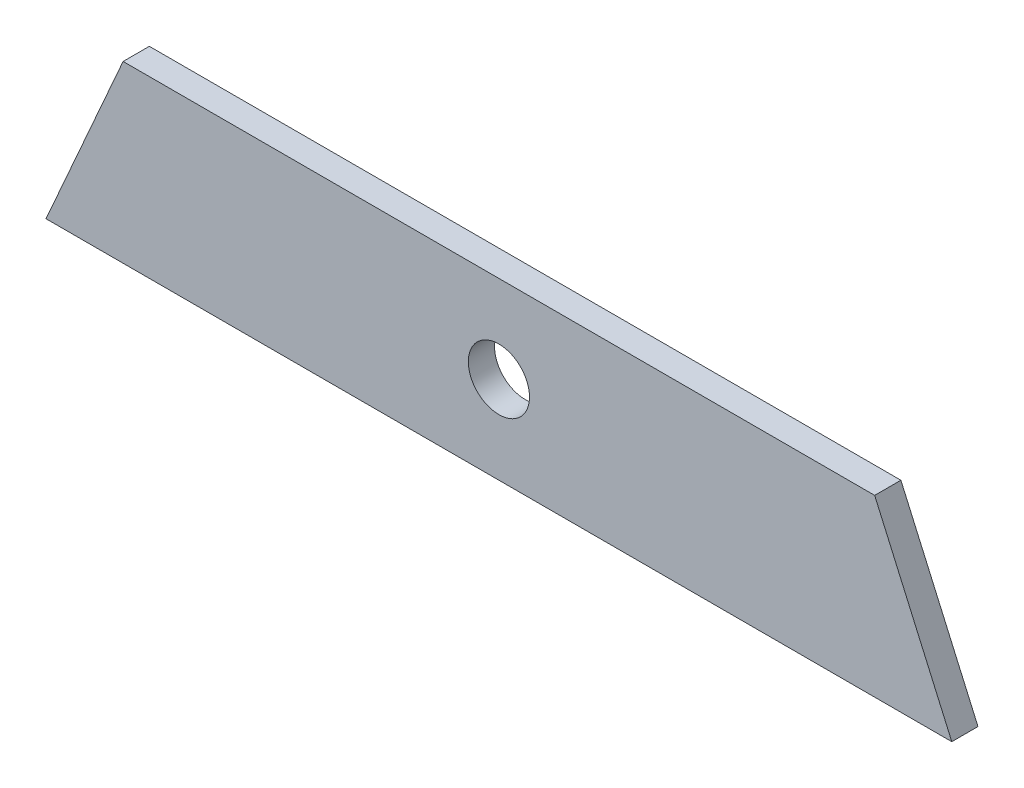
SolidWorks part; units mm, degrees
ref_plane "Plan1" through (0, 0, 0) normal (0, 0, 1) x (1, 0, 0)
ref_plane "Plan2" through (0, 0, 0) normal (0, 1, 0) x (1, 0, 0)
ref_plane "Plan3" through (0, 0, 0) normal (1, 0, 0) x (0, 0, -1)
sketch "Esquisse1" plane through (0, 0, 0) normal (0, 0, 1) x (1, 0, 0)
  line L0 (-43, 20) -> (43, 20)
  line L1 (43, 20) -> (51.8231, 0)
  line L2 (51.8231, 0) -> (-51.8231, 0)
  line L3 (-51.8231, 0) -> (-43, 20)
  circle A0 centre (0, 10) radius 3.5
  dimension "D6" = 7
  dimension "D1" = 20
  dimension "D2" = 47.61
  dimension "D3" = 66.195
  dimension "D4" = 86
  dimension "D5" = 10
extrude "Base-Extrusion" add sketch "Esquisse1" along normal blind 3
